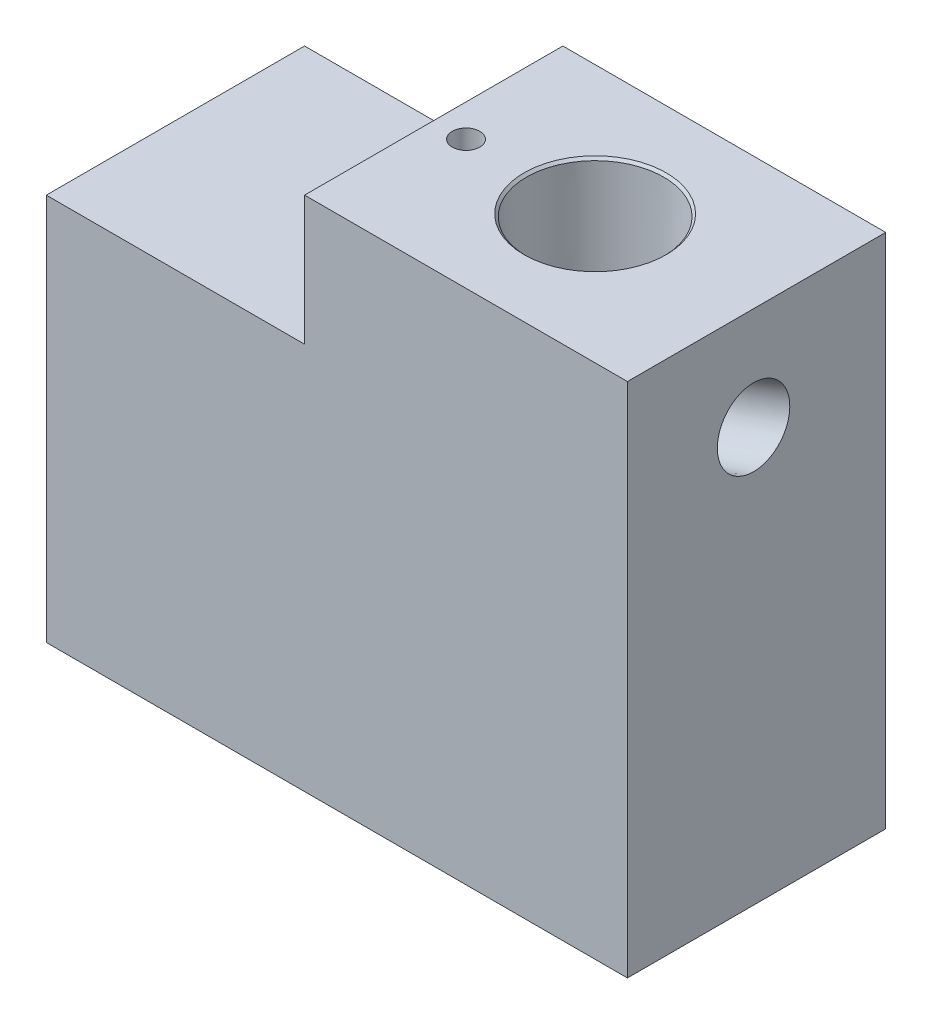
SolidWorks part; units mm, degrees
ref_plane "Front Plane" through (0, 0, 0) normal (0, 0, 1) x (1, 0, 0)
ref_plane "Top Plane" through (0, 0, 0) normal (0, 1, 0) x (1, 0, 0)
ref_plane "Right Plane" through (0, 0, 0) normal (1, 0, 0) x (0, 0, -1)
sketch "Sketch1" plane through (0, 0, 0) normal (0, 1, 0) x (1, 0, 0)
  line L1 (0, 0) -> (114.3, 0)
  line L2 (0, 0) -> (0, 50.8)
  line L3 (0, 50.8) -> (114.3, 50.8)
  line L4 (114.3, 0) -> (114.3, 50.8)
  dimension "D1" = 50.8
  dimension "D2" = 114.3
extrude "Boss-Extrude1" add sketch "Sketch1" along normal blind 101.6
hole_wizard "3/4 NPT Tapped Hole1" positions "Sketch4" profile "Sketch3" size "3/4" standard "ANSI Inch"
sketch "Sketch4" plane through (0, 101.6, 0) normal (0, 1, 0) x (-1, 0, 0)
  line L0 (-114.3, 0) -> (-114.3, -50.8) construction
  line L1 (0, 0) -> (-114.3, 0) construction
  point P0 (-82.55, -25.4)
  dimension "D1" = 31.75
  dimension "D2" = 25.4
sketch "Sketch3" plane through (82.55, 101.6, -25.4) normal (1, 0, 0) x (0, 0, 1)
  line L0 (0, 0) -> (0, 37.3936)
  line L1 (11.5062, 30.48) -> (0, 37.3936)
  line L2 (-11.5062, 30.48) -> (0, 37.3936) construction
  line L3 (11.5062, 30.48) -> (11.5062, 19.05)
  line L4 (11.5062, 19.05) -> (12.9287, 19.05)
  line L5 (12.9287, 19.05) -> (13.4846, 0.4854)
  line L6 (13.4846, 0.4854) -> (13.97, 0)
  line L7 (13.97, 0) -> (0, 0)
  line L8 (0, -6.35) -> (0, 107.95) construction
  line L9 (-13.4846, 0.4854) -> (-13.97, 0) construction
  line L11 (-11.5062, 19.05) -> (-12.9287, 19.05) construction
  line L12 (-12.9287, 19.05) -> (-13.4846, 0.4854) construction
  dimension "Tap Drill Dia." = 23.0124
  dimension "Tap Drill Depth" = 30.48
  dimension "Thread Dia." = 26.9692
  dimension "Thread Angle" = 3.43
  dimension "Thread Depth" = 19.05
  dimension "C'Sink Dia." = 27.94
  dimension "C'Sink Angle" = 90
  dimension "Drill Angle" = 118
hole_wizard "3/8 NPT Tapped Hole1" positions "Sketch6" profile "Sketch5" size "3/8" standard "ANSI Inch"
sketch "Sketch6" plane through (0, 0, 0) normal (0, -1, 0) x (1, 0, 0)
  line L0 (0, 0) -> (114.3, 0) construction
  line L1 (114.3, 0) -> (114.3, -50.8) construction
  point P0 (57.15, -25.4)
  point P2 (25.4, -25.4)
  dimension "D1" = 25.4
  dimension "D2" = 31.75
  dimension "D3" = 57.15
sketch "Sketch5" plane through (57.15, 0, -25.4) normal (1, 0, 0) x (0, 0, -1)
  line L0 (0, 0) -> (0, 62.7086)
  line L1 (7.1374, 58.42) -> (0, 62.7086)
  line L2 (-7.1374, 58.42) -> (0, 62.7086) construction
  line L3 (7.1374, 58.42) -> (7.1374, 19.05)
  line L4 (7.1374, 19.05) -> (8.2725, 19.05)
  line L5 (8.2725, 19.05) -> (8.8336, 0.3104)
  line L6 (8.8336, 0.3104) -> (9.144, 0)
  line L7 (9.144, 0) -> (0, 0)
  line L8 (0, -6.35) -> (0, 107.95) construction
  line L9 (-8.8336, 0.3104) -> (-9.144, 0) construction
  line L11 (-7.1374, 19.05) -> (-8.2725, 19.05) construction
  line L12 (-8.2725, 19.05) -> (-8.8336, 0.3104) construction
  dimension "Tap Drill Dia." = 14.2748
  dimension "Tap Drill Depth" = 58.42
  dimension "Thread Dia." = 17.6672
  dimension "Thread Angle" = 3.43
  dimension "Thread Depth" = 19.05
  dimension "C'Sink Dia." = 18.288
  dimension "C'Sink Angle" = 90
  dimension "Drill Angle" = 118
sketch "Sketch7" plane through (0, 101.6, 0) normal (0, 1, 0) x (1, 0, 0)
  line L0 (114.3, 50.8) -> (0, 50.8) construction
  line L1 (0, 0) -> (50.8, 0)
  line L2 (0, 0) -> (0, 50.8)
  line L3 (0, 50.8) -> (50.8, 50.8)
  line L4 (50.8, 0) -> (50.8, 50.8)
  dimension "D1" = 50.8
extrude "Cut-Extrude1" cut sketch "Sketch7" against normal blind 25.4
sketch "Sketch10" plane through (0, 101.6, 0) normal (0, 1, 0) x (1, 0, 0)
  circle A0 centre (57.15, 25.4) radius 8.8336 construction
  circle A1 centre (57.15, 25.4) radius 8.8336 construction
  circle A2 centre (57.15, 25.4) radius 1.5875
  dimension "D1" = 3.175
hole_wizard "1/4-28 Tapped Hole1" positions "Sketch12" profile "Sketch11" tap size "1/4-28" standard "ANSI Inch"
sketch "Sketch12" plane through (0, 101.6, 0) normal (0, 1, 0) x (1, 0, 0)
  point P0 (57.15, 25.4)
sketch "Sketch11" plane through (57.15, 101.6, -25.4) normal (1, 0, 0) x (0, 0, 1)
  line L0 (0, 0) -> (0, 14.3254)
  line L1 (0, 14.3254) -> (2.7051, 12.7)
  line L2 (2.7051, 12.7) -> (2.7051, 0)
  line L5 (2.7051, 0) -> (0, 0)
  line L10 (0, 14.3254) -> (-2.7051, 12.7) construction
  line L11 (0, -6.35) -> (0, 107.95) construction
  dimension "Tap Drill Dia." = 5.4102
  dimension "Tap Drill Depth" = 12.7
  dimension "Drill Angle" = 118
extrude "Cut-Extrude2" cut sketch "Sketch10" against normal up to next
ref_plane "Plane1" through (133.5831, 48.6203, 0) normal (0.9397, 0.342, 0) x (0, 0, -1)
hole_wizard "1/4 NPT Tapped Hole3" positions "Sketch23" profile "Sketch22" size "1/4" standard "ANSI Inch"
sketch "Sketch23" plane through (133.5831, 48.6203, 0) normal (0.9397, 0.342, 0) x (0, 0, -1)
  line L0 (0, 56.3799) -> (50.8, 56.3799) construction
  point P0 (24.8106, 37.3299)
  dimension "D1" = 19.05
sketch "Sketch22" plane through (120.8155, 83.6989, -24.8106) normal (0, 0, 1) x (-0.342, 0.9397, 0)
  line L0 (0, 0) -> (0, 104.9423)
  line L1 (5.5626, 101.6) -> (0, 104.9423)
  line L2 (-5.5626, 101.6) -> (0, 104.9423) construction
  line L3 (5.5626, 101.6) -> (5.5626, 25.4)
  line L4 (5.5626, 25.4) -> (6.567, 25.4)
  line L5 (6.567, 25.4) -> (7.3185, 0.3015)
  line L6 (7.3185, 0.3015) -> (7.62, 0)
  line L7 (7.62, 0) -> (0, 0)
  line L8 (0, -6.35) -> (0, 107.95) construction
  line L9 (-7.3185, 0.3015) -> (-7.62, 0) construction
  line L11 (-5.5626, 25.4) -> (-6.567, 25.4) construction
  line L12 (-6.567, 25.4) -> (-7.3185, 0.3015) construction
  dimension "Tap Drill Dia." = 11.1252
  dimension "Tap Drill Depth" = 101.6
  dimension "Thread Dia." = 14.637
  dimension "Thread Angle" = 3.43
  dimension "Thread Depth" = 25.4
  dimension "C'Sink Dia." = 15.24
  dimension "C'Sink Angle" = 90
  dimension "Drill Angle" = 118
hole_wizard "#10-32 Tapped Hole1" positions "Sketch30" profile "Sketch31" tap size "#10-32" standard "ANSI Inch"
sketch "Sketch30" plane through (0, 0, 0) normal (0, -1, 0) x (-1, 0, 0)
  point P4 (-9.0397, 42.672)
  point P7 (-9.0397, 8.128)
  point P10 (-102.363, 38.1)
  point P13 (-102.363, 12.7)
sketch "Sketch31" plane through (9.0397, 0, -42.672) normal (1, 0, 0) x (0, 0, -1)
  line L0 (0, 0) -> (0, 26.6133)
  line L1 (0, 26.6133) -> (2.0193, 25.4)
  line L2 (2.0193, 25.4) -> (2.0193, 0)
  line L5 (2.0193, 0) -> (0, 0)
  line L10 (0, 26.6133) -> (-2.0193, 25.4) construction
  line L11 (0, -6.35) -> (0, 107.95) construction
  dimension "Tap Drill Dia." = 4.0386
  dimension "Tap Drill Depth" = 25.4
  dimension "Drill Angle" = 118
